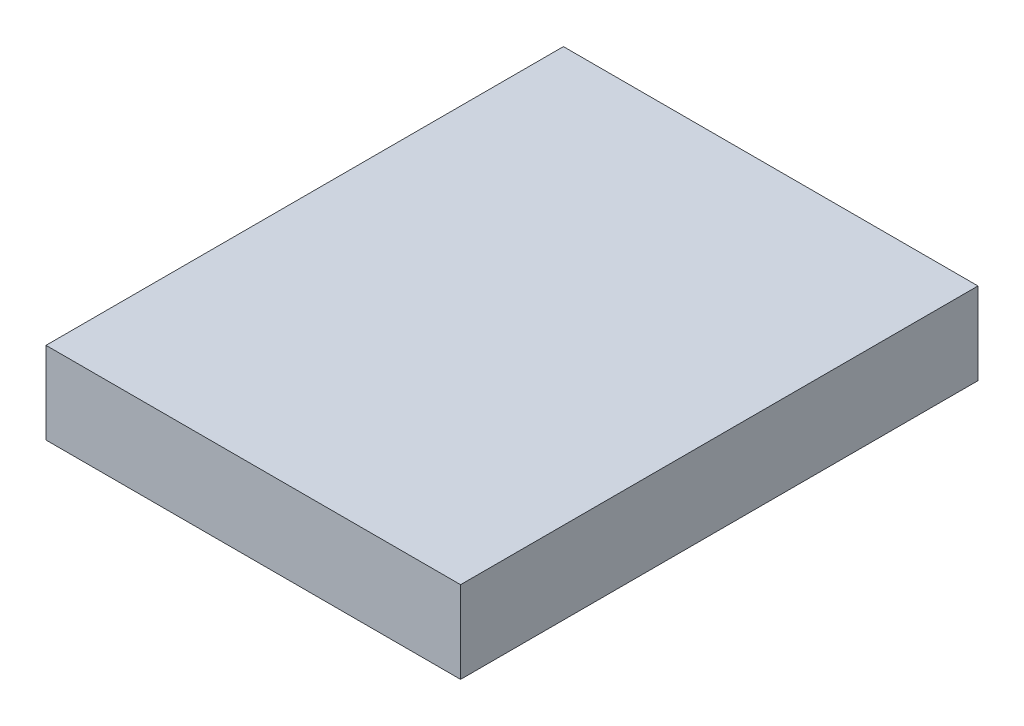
SolidWorks part; units mm, degrees
ref_plane "Front Plane" through (0, 0, 0) normal (0, 0, 1) x (1, 0, 0)
ref_plane "Top Plane" through (0, 0, 0) normal (0, 1, 0) x (1, 0, 0)
ref_plane "Right Plane" through (0, 0, 0) normal (1, 0, 0) x (0, 0, -1)
sketch "Sketch1"
extrude "Extrude1" add sketch "Sketch1" along normal blind 64
